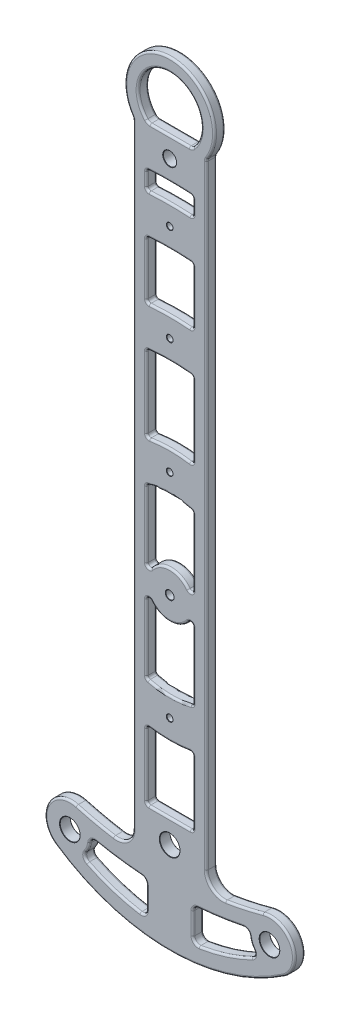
SolidWorks part; units mm, degrees
ref_plane "Спереди" through (0, 0, 0) normal (0, 0, 1) x (1, 0, 0)
ref_plane "Сверху" through (0, 0, 0) normal (0, 1, 0) x (1, 0, 0)
ref_plane "Справа" through (0, 0, 0) normal (1, 0, 0) x (0, 0, -1)
sketch "Эскиз1" plane through (0, 0, 0) normal (0, 0, 1) x (1, 0, 0)
  line L0 (0, 398) -> (93.5, 398) construction
  line L1 (-29.507, 438.24) -> (29.507, 438.24)
  line L2 (-55, 430.8917) -> (-55, -491.4816)
  line L3 (0, 472.5) -> (0, -805.2846) construction
  line L4 (55, 430.8917) -> (55, -491.4816)
  line L5 (-35, -554.2846) -> (-35, -587.3339)
  line L6 (35, -554.2846) -> (35, -587.3339)
  line L7 (-31, -450) -> (31, -450)
  line L8 (-35, -446) -> (-35, -352.115)
  line L9 (-30, 442.396) -> (-30, -491.4816) construction
  line L10 (30, 442.396) -> (30, -491.4816) construction
  line L11 (35, -446) -> (35, -352.115)
  line L12 (35, -36.7384) -> (35, -136.3357)
  line L13 (-35, -36.7384) -> (-35, -136.3357)
  line L14 (-35, 32.115) -> (-35, 138.8967)
  line L15 (35, 32.115) -> (35, 138.8967)
  line L16 (-35, -183.6643) -> (-35, -283.2616)
  line L17 (35, -183.6643) -> (35, -283.2616)
  line L18 (-35, 207.1185) -> (-35, 285.2471)
  line L19 (35, 207.1185) -> (35, 285.2471)
  line L20 (-35, 353.3148) -> (-35, 372.849)
  line L21 (35, 353.3148) -> (35, 372.849)
  line L22 (55, 433.3688) -> (55, -491.4816) construction
  line L23 (-55, 433.3688) -> (-55, -491.4816) construction
  circle A0 centre (0, 0) radius 4.55
  circle A1 centre (0, 174) radius 4.55
  circle A2 centre (0, 320) radius 4.55
  circle A3 centre (0, -160) radius 6.1
  circle A4 centre (0, -320) radius 4.55
  circle A5 centre (0, -485) radius 15
  circle A6 centre (0, 408) radius 10
  arc A7 (56.3245, 435.3005) -> (-56.3245, 435.3005) centre (0, 472.5) ccw
  arc A8 (35.4831, 440.9215) -> (-35.4831, 440.9215) centre (0, 472.5) ccw
  circle A9 centre (0, 472.5) radius 47.5 construction
  circle A10 centre (0, 472.5) radius 67.5 construction
  arc A11 (-139.9639, -503.8718) -> (-84.0165, -516.1569) centre (0, 0) ccw
  arc A12 (84.0165, -516.1569) -> (139.9639, -503.8718) centre (0, 0) ccw
  circle A13 centre (-150, -540.0018) radius 15
  arc A14 (-171.1239, -570.9837) -> (171.1239, -570.9837) centre (0, -320) ccw
  circle A15 centre (150, -540.0018) radius 15
  arc A16 (-139.9639, -503.8718) -> (-171.1239, -570.9837) centre (-150, -540.0018) ccw
  arc A17 (139.9639, -503.8718) -> (171.1239, -570.9837) centre (150, -540.0018) cw
  arc A18 (55, -491.4816) -> (84.0165, -516.1569) centre (80, -491.4816) ccw
  arc A19 (-55, -491.4816) -> (-84.0165, -516.1569) centre (-80, -491.4816) cw
  arc A20 (-110.6513, -536.6614) -> (-42.3812, -546.3086) centre (0, 0) ccw
  arc A21 (88.0329, -540.8321) -> (146.655, -527.9598) centre (0, 0) ccw construction
  arc A22 (-146.655, -527.9598) -> (-88.0329, -540.8321) centre (0, 0) ccw construction
  arc A23 (44.2705, -595.2323) -> (123.2029, -570.0675) centre (0, -320) ccw
  arc A24 (42.3812, -546.3086) -> (110.6513, -536.6614) centre (0, 0) ccw
  arc A25 (-157.0405, -550.328) -> (157.0405, -550.328) centre (0, -320) ccw construction
  arc A26 (-123.2029, -570.0675) -> (-44.2705, -595.2323) centre (0, -320) ccw
  arc A27 (-126.0531, -558.0724) -> (-120.2106, -543.5503) centre (-150, -540.0018) ccw
  arc A28 (-146.655, -527.9598) -> (-157.0405, -550.328) centre (-150, -540.0018) ccw construction
  arc A29 (-30, -491.4816) -> (-88.0329, -540.8321) centre (-80, -491.4816) cw construction
  arc A30 (30, -491.4816) -> (88.0329, -540.8321) centre (80, -491.4816) ccw construction
  arc A31 (146.655, -527.9598) -> (157.0405, -550.328) centre (150, -540.0018) cw construction
  arc A32 (30, 442.396) -> (-30, 442.396) centre (0, 472.5) ccw construction
  arc A33 (126.0531, -558.0724) -> (120.2106, -543.5503) centre (150, -540.0018) cw
  circle A34 centre (-150, -540.0018) radius 30 construction
  circle A35 centre (150, -540.0018) radius 30 construction
  arc A36 (123.2029, -570.0675) -> (126.0531, -558.0724) centre (119.6673, -562.8912) ccw
  arc A37 (110.6513, -536.6614) -> (120.2106, -543.5503) centre (112.2668, -544.4966) cw
  arc A38 (35, -587.3339) -> (44.2705, -595.2323) centre (43, -587.3339) ccw
  arc A39 (42.3812, -546.3086) -> (35, -554.2846) centre (43, -554.2846) ccw
  arc A40 (-42.3812, -546.3086) -> (-35, -554.2846) centre (-43, -554.2846) cw
  arc A41 (-35, -587.3339) -> (-44.2705, -595.2323) centre (-43, -587.3339) cw
  arc A42 (-126.0531, -558.0724) -> (-123.2029, -570.0675) centre (-119.6673, -562.8912) ccw
  arc A43 (-120.2106, -543.5503) -> (-110.6513, -536.6614) centre (-112.2668, -544.4966) cw
  arc A44 (-30.3628, -348.166) -> (30.3628, -348.166) centre (0, -160) ccw
  arc A45 (30.3628, 28.166) -> (-30.3628, 28.166) centre (0, -160) ccw
  arc A46 (31.9756, -32.8592) -> (-31.9756, -32.8592) centre (0, -160) ccw
  arc A47 (-31.9756, -287.1408) -> (31.9756, -287.1408) centre (0, -160) ccw
  arc A48 (-27.8205, -181.2372) -> (27.8205, -181.2372) centre (0, -160) ccw
  arc A49 (35, -36.7384) -> (31.9756, -32.8592) centre (31, -36.7384) ccw
  arc A50 (-35, -36.7384) -> (-31.9756, -32.8592) centre (-31, -36.7384) cw
  arc A51 (35, -283.2616) -> (31.9756, -287.1408) centre (31, -283.2616) cw
  arc A52 (-35, -283.2616) -> (-31.9756, -287.1408) centre (-31, -283.2616) ccw
  arc A53 (-35, -352.115) -> (-30.3628, -348.166) centre (-31, -352.115) cw
  arc A54 (35, -352.115) -> (30.3628, -348.166) centre (31, -352.115) ccw
  arc A55 (35, -446) -> (31, -450) centre (31, -446) cw
  arc A56 (-31, -450) -> (-35, -446) centre (-31, -446) cw
  arc A57 (-35, -136.3357) -> (-27.8205, -138.7628) centre (-31, -136.3357) ccw
  arc A58 (-27.8205, -181.2372) -> (-35, -183.6643) centre (-31, -183.6643) ccw
  arc A59 (27.8205, -181.2372) -> (35, -183.6643) centre (31, -183.6643) cw
  arc A60 (35, -136.3357) -> (27.8205, -138.7628) centre (31, -136.3357) cw
  arc A61 (27.8205, -138.7628) -> (-27.8205, -138.7628) centre (0, -160) ccw
  arc A62 (30.6634, 203.1327) -> (-30.6634, 203.1327) centre (0, -160) ccw
  arc A63 (31.4126, 142.8754) -> (-31.4126, 142.8754) centre (0, -160) ccw
  arc A64 (30.6634, 203.1327) -> (35, 207.1185) centre (31, 207.1185) ccw
  arc A65 (-30.6634, 203.1327) -> (-35, 207.1185) centre (-31, 207.1185) cw
  arc A66 (-31.4126, 142.8754) -> (-35, 138.8967) centre (-31, 138.8967) ccw
  arc A67 (31.4126, 142.8754) -> (35, 138.8967) centre (31, 138.8967) cw
  arc A68 (35, 32.115) -> (30.3628, 28.166) centre (31, 32.115) cw
  arc A69 (-35, 32.115) -> (-30.3628, 28.166) centre (-31, 32.115) ccw
  arc A70 (30.7589, 349.3221) -> (-30.7589, 349.3221) centre (0, -160) ccw
  arc A71 (31.2778, 289.2375) -> (-31.2778, 289.2375) centre (0, -160) ccw
  arc A72 (30.7589, 349.3221) -> (35, 353.3148) centre (31, 353.3148) ccw
  arc A73 (-30.7589, 349.3221) -> (-35, 353.3148) centre (-31, 353.3148) cw
  arc A74 (31.2778, 289.2375) -> (35, 285.2471) centre (31, 285.2471) cw
  arc A75 (-31.2778, 289.2375) -> (-35, 285.2471) centre (-31, 285.2471) ccw
  arc A76 (31.2323, 376.8423) -> (-31.2323, 376.8423) centre (0, -160) ccw
  arc A77 (35, 372.849) -> (31.2323, 376.8423) centre (31, 372.849) ccw
  arc A78 (-35, 372.849) -> (-31.2323, 376.8423) centre (-31, 372.849) cw
  arc A79 (35.4831, 440.9215) -> (29.507, 438.24) centre (29.507, 446.24) cw
  arc A80 (-35.4831, 440.9215) -> (-29.507, 438.24) centre (-29.507, 446.24) ccw
  arc A81 (55, 433.3688) -> (-55, 433.3688) centre (0, 472.5) ccw construction
  arc A82 (55, 430.8917) -> (56.3245, 435.3005) centre (63, 430.8917) cw
  arc A83 (-55, 430.8917) -> (-56.3245, 435.3005) centre (-63, 430.8917) ccw
  point P38 (55, -520.0497)
  point P108 (-35, -286.3416)
  point P111 (-35, -347.3589)
  point P114 (35, -347.3589)
  point P136 (35, 202.7404)
  point P139 (-35, 202.7404)
  point P154 (35, 349.0482)
  point P157 (-35, 349.0482)
  point P173 (55, 433.3688)
  dimension "D1" = 9.1
  dimension "D4" = 12.2
  dimension "D7" = 30
  dimension "D9" = 20
  dimension "D11" = 135
  dimension "D16" = 1045.9
  dimension "D17" = 303.77
  dimension "D19" = 25
  dimension "D26" = 8
  dimension "D28" = 381.2
  dimension "D29" = 262.2
  dimension "D30" = 70
  dimension "D31" = 4
  dimension "D32" = 728.85
  dimension "D33" = 609
  dimension "D34" = 4
  dimension "D35" = 450.325
  dimension "D36" = 1020.5
  dimension "D37" = 4
  dimension "D38" = 1075.5
  dimension "D39" = 4
  dimension "D40" = 8
  dimension "D41" = 8
  dimension "D2" = 174
  dimension "D3" = 146
  dimension "D5" = 160
  dimension "D6" = 160
  dimension "D8" = 165
  dimension "D10" = 88
  dimension "D13" = 64.5
  dimension "D14" = 40.24
  dimension "D15" = 110
  dimension "D18" = 55
  dimension "D20" = 300
  dimension "D21" = 70
  dimension "D23" = 35
  dimension "D27" = 35
  dimension "D42" = 55
  dimension "D12" = 20
  dimension "D22" = 25
  dimension "D24" = 15
  dimension "D25" = 15
extrude "Бобышка-Вытянуть1" add sketch "Эскиз1" along normal blind 16
fillet "Скругление1" radius 3 120 edges at (-33.7419, 350.4023, 0) (0, 377.75, 0) (35, 363.0819, 0) (-35, 246.1828, 0) (-33.925, 287.9756, 0) (0, 290.325, 0) (33.925, 287.9756, 0) (35, 246.1828, 0) (33.7068, 204.1735, 0) (-33.5934, 29.0696, 0) (-35, 85.5058, 0) (-33.9707, 141.5753, 0) (0, 144.5, 0) (35, 85.5058, 0) (33.5934, 29.0696, 0) (-32.281, -140.125, 0) (-34.1546, -34.279, 0) (0, -28.9, 0) (34.1546, -34.279, 0) (35, -86.5371, 0) (-35, -233.4629, 0) (-32.281, -179.875, 0) (32.281, -179.875, 0) (35, -233.4629, 0) (34.1546, -285.721, 0) (-33.8284, -448.8284, 0) (-35, -399.0575, 0) (0, -350.6, 0) (33.5934, -349.0696, 0) (35, -399.0575, 0) (33.8284, -448.8284, 0) (-55, -30.295, 0) (-63.8045, -510.5265, 0) (-112.1585, -510.7809, 0) (-184.0108, -524.2106, 0) (0, -623.77, 0) (184.0108, -524.2106, 0) (112.1585, -510.7809, 0) (-37.8117, -593.4233, 0) (-84.6767, -585.5985, 0) (-127.4506, -564.7406, 0) (-122.168, -551.1991, 0) (-76.6681, -542.5599, 0) (-37.1285, -548.8509, 0) (37.1285, -548.8509, 0) (76.6681, -542.5599, 0) (116.944, -538.0063, 0) (122.168, -551.1991, 0) (127.4506, -564.7406, 0) (84.6767, -585.5985, 0) (84.6767, -585.5985, 16) (37.8117, -593.4233, 16) (37.1285, -548.8509, 16) (-37.1285, -548.8509, 16) (-35, -570.8092, 16) (-37.8117, -593.4233, 16) (-84.6767, -585.5985, 16) (-127.4506, -564.7406, 16) (-122.168, -551.1991, 16) (-116.944, -538.0063, 16) (35, -399.0575, 16) (33.8284, -448.8284, 16) (0, -450, 16) (-33.8284, -448.8284, 16) (32.281, -179.875, 16) (35, -233.4629, 16) (34.1546, -285.721, 16) (-32.281, -179.875, 16) (32.281, -140.125, 16) (-32.281, -140.125, 16) (33.9707, 141.5753, 16) (35, 85.5058, 16) (33.5934, 29.0696, 16) (0, 30.6, 16) (-33.5934, 29.0696, 16) (-33.9707, 141.5753, 16) (35, 246.1828, 16) (33.7068, 204.1735, 16) (-33.7068, 204.1735, 16) (-35, 246.1828, 16) (33.9094, 375.5941, 16) (35, 363.0819, 16) (0, 350.25, 16) (-33.7419, 350.4023, 16) (-35, 363.0819, 16) (-63.8045, -510.5265, 16) (-112.1585, -510.7809, 16) (-184.0108, -524.2106, 16) (0, -623.77, 16) (184.0108, -524.2106, 16) (112.1585, -510.7809, 16) (63.8045, -510.5265, 16) (0, 520, 0) (0, 438.24, 0) (0, 350.25, 0) (0, 30.6, 0) (0, -125, 0) (0, -291.1, 0) (0, -450, 0) (55, -30.295, 0) (-35, -570.8092, 0) (35, -570.8092, 0) (-76.6681, -542.5599, 16) (0, -350.6, 16) (0, -195, 16) (0, -28.9, 16) (0, 144.5, 16) (0, 377.75, 16) (0, 520, 16) (0, 438.24, 16) (55, -30.295, 16) (-32.7821, 438.9411, 0) (32.7821, 438.9411, 0) (-32.7821, 438.9411, 16) (32.7821, 438.9411, 16) (-55.3383, 433.1934, 0) (0, 540, 0) (55.3383, 433.1934, 0) (-55.3383, 433.1934, 16) (55.3383, 433.1934, 16)
chamfer "Фаска1" distance 0.5 angle 45 18 edges at (135, -540.0018, 0) (135, -540.0018, 16) (-135, -540.0018, 0) (-135, -540.0018, 16) (15, -485, 0) (15, -485, 16) (4.55, -320, 0) (4.55, -320, 16) (6.1, -160, 0) (6.1, -160, 16) (4.55, 0, 0) (4.55, 0, 16) (4.55, 174, 0) (4.55, 174, 16) (4.55, 320, 0) (4.55, 320, 16) (10, 408, 0) (10, 408, 16)
